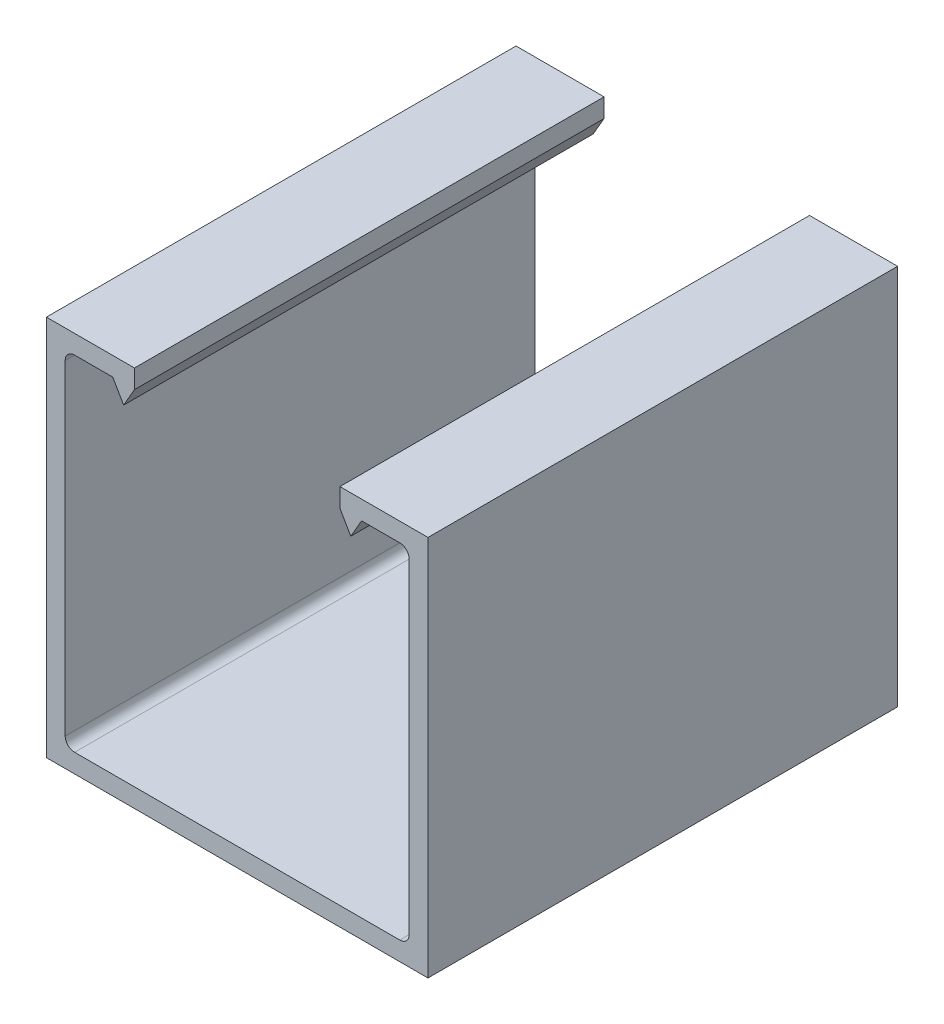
SolidWorks part; units mm, degrees
ref_plane "Plane1" through (0, 0, 0) normal (0, 0, 1) x (1, 0, 0)
ref_plane "Plane2" through (0, 0, 0) normal (0, 1, 0) x (1, 0, 0)
ref_plane "Plane3" through (0, 0, 0) normal (1, 0, 0) x (0, 0, -1)
sketch "Sketch1" plane through (0, 0, 0) normal (0, 0, 1) x (1, 0, 0)
  line L0 (-5.5563, 10.3187) -> (-10.3188, 10.3187)
  line L1 (-10.3188, 10.3187) -> (-10.3187, -10.3187)
  line L2 (-10.3187, -10.3187) -> (10.3188, -10.3187)
  line L3 (10.3188, -10.3187) -> (10.3187, 10.3188)
  line L4 (10.3187, 10.3188) -> (5.5562, 10.3188)
  line L5 (8.7948, 9.3028) -> (6.7294, 9.3028)
  line L6 (9.3028, -8.7948) -> (9.3027, 8.7948)
  line L7 (-8.7947, -9.3028) -> (8.7948, -9.3028)
  line L8 (-9.3027, 8.7947) -> (-9.3027, -8.7948)
  line L9 (-6.7294, 9.3027) -> (-8.7948, 9.3027)
  line L10 (6.7294, 9.3028) -> (6.1428, 8.2868)
  line L11 (6.1428, 8.2868) -> (5.5562, 9.3028)
  line L12 (5.5562, 9.3028) -> (5.5562, 10.3188)
  line L13 (-6.7294, 9.3027) -> (-6.1428, 8.2868)
  line L14 (-6.1428, 8.2868) -> (-5.5563, 9.3027)
  line L15 (-5.5563, 9.3027) -> (-5.5563, 10.3187)
  arc A0 (-9.3027, -8.7948) -> (-8.7947, -9.3028) centre (-8.7947, -8.7948) ccw
  arc A1 (-8.7948, 9.3027) -> (-9.3027, 8.7947) centre (-8.7948, 8.7947) ccw
  arc A2 (9.3027, 8.7948) -> (8.7948, 9.3028) centre (8.7948, 8.7948) ccw
  arc A3 (8.7948, -9.3028) -> (9.3028, -8.7948) centre (8.7948, -8.7948) ccw
  dimension "D5" = 0.508
  dimension "D4" = 60
  dimension "Width" = 20.6375
  dimension "Height" = 20.6375
  dimension "D8" = 10.3187
  dimension "D9" = 10.3187
  dimension "D10" = 11.1125
  dimension "edge" = 4.7625
  dimension "D13" = 0.5866
extrude "Base-Extrude" add sketch "Sketch1" along normal mid plane 25.4
equation "\"D8@Sketch1\" = \"Width@Sketch1\" / 2"
equation "\"D9@Sketch1\" = \"Height@Sketch1\" / 2"
equation "\"D10@Sketch1\" = \"Width@Sketch1\" - 2 * \"edge@Sketch1\""
equation "\"D5@Sketch1\" = \"gauge@Sketch1\" / 2"
equation "\"D13@Sketch1\" = \"gauge@Sketch1\" * .577350269"
